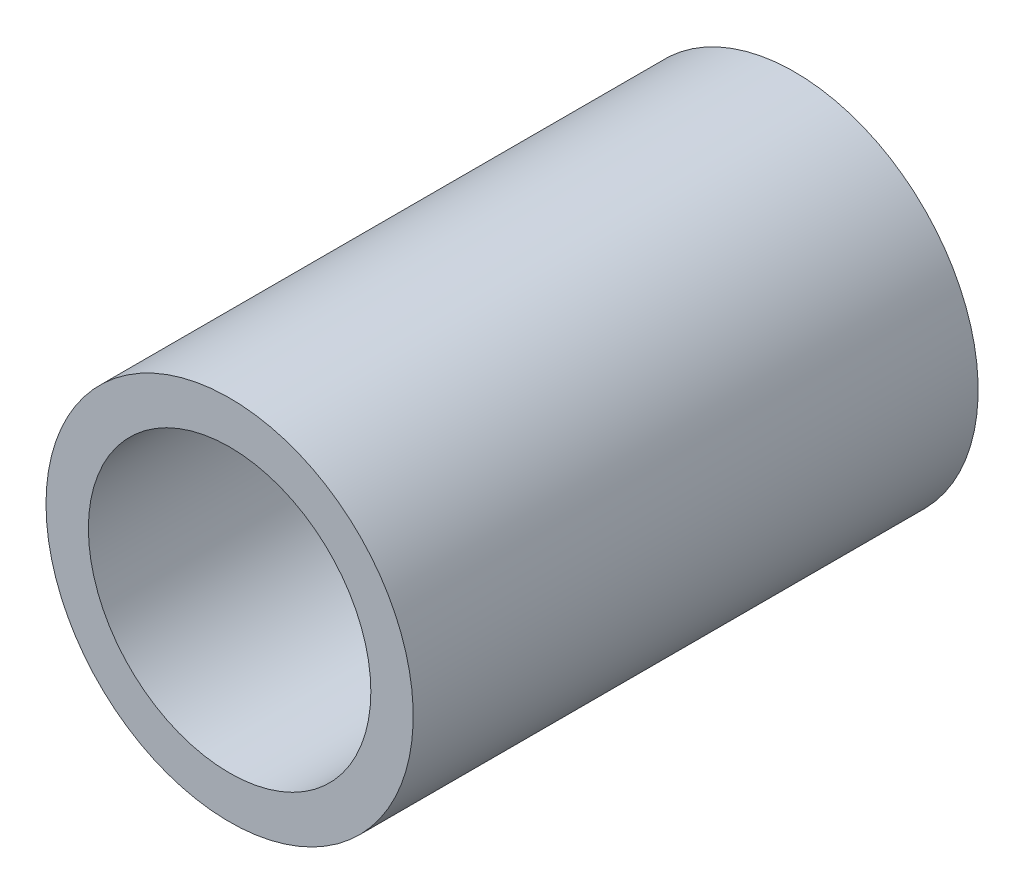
SolidWorks part; units mm, degrees
ref_plane "Plan de face" through (0, 0, 0) normal (0, 0, 1) x (1, 0, 0)
ref_plane "Plan de dessus" through (0, 0, 0) normal (0, 1, 0) x (1, 0, 0)
ref_plane "Plan de droite" through (0, 0, 0) normal (1, 0, 0) x (0, 0, -1)
sketch "Esquisse1" plane through (0, 0, 0) normal (0, 0, 1) x (1, 0, 0)
  circle A0 centre (0, 0) radius 13
  circle A1 centre (0, 0) radius 10
  dimension "D1" = 20
  dimension "D2" = 26
extrude "Boss.-Extru.1" add sketch "Esquisse1" along normal blind 40
